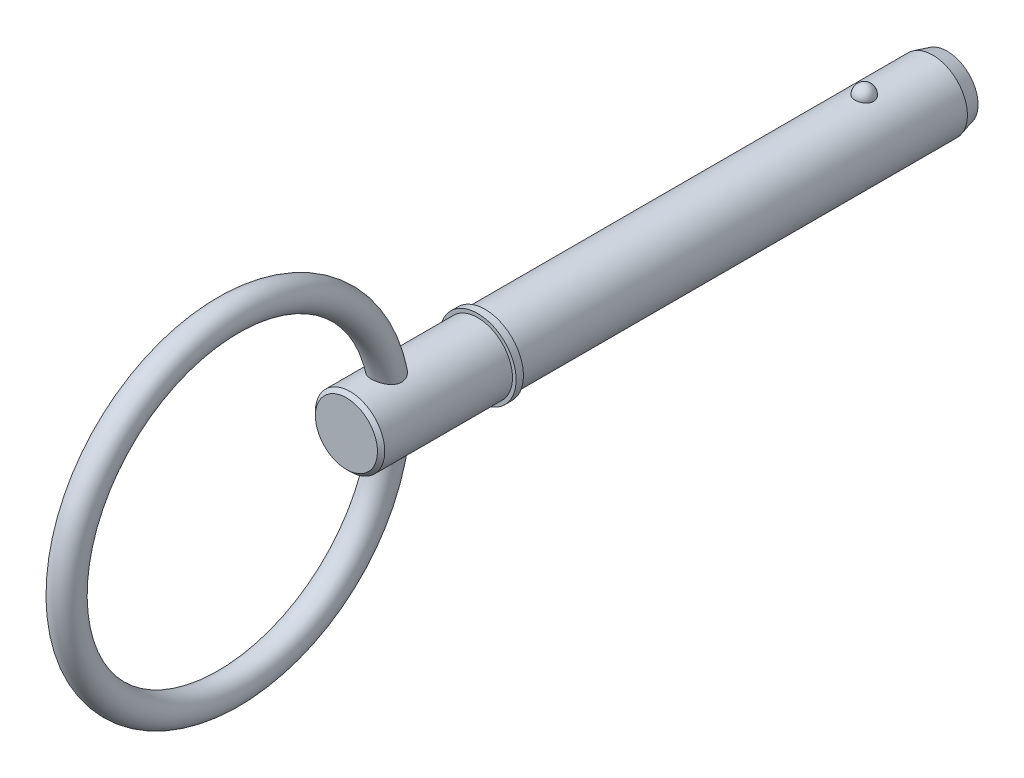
SolidWorks part; units mm, degrees
ref_plane "Front Plane" through (0, 0, 0) normal (0, 0, 1) x (1, 0, 0)
ref_plane "Top Plane" through (0, 0, 0) normal (0, 1, 0) x (1, 0, 0)
ref_plane "Right Plane" through (0, 0, 0) normal (1, 0, 0) x (0, 0, -1)
sketch "Sketch2" plane through (0, 0, 0) normal (0, 0, 1) x (1, 0, 0)
  circle A0 centre (0, 0) radius 4.765
  point P3 (0, 4.765)
  dimension "D1" = 9.53
extrude "Boss-Extrude1" add sketch "Sketch2" along normal blind 50.8
sketch "Sketch3" plane through (0, 0, 0) normal (0, 0, -1) x (-1, 0, 0)
  circle A0 centre (0, 0) radius 4.765
  dimension "D1" = 9.53
extrude "Boss-Extrude2" add sketch "Sketch3" along normal blind 12.7
chamfer "Chamfer1" distance 2 angle 15 1 edges at (-4.765, 0, -12.7)
sketch "Sketch18" plane through (0, 0, 0) normal (1, 0, 0) x (0, 0, -1)
  line L0 (10.7, 4.765) -> (-50.8, 4.765) construction
  line L1 (1.29, 6.055) -> (1.29, 3.475)
  line L2 (-50.8, -4.765) -> (10.7, -4.765) construction
  arc A0 (1.29, 6.055) -> (1.29, 3.475) centre (1.29, 4.765) ccw
  point P4 (0, 4.765)
  dimension "D1" = 10.82
revolve "Revolve1" add sketch "Sketch18" angle 360 about L1
sketch "Sketch19" plane through (0, 0, 0) normal (1, 0, 0) x (0, 0, -1)
  line L0 (-33.7288, 0) -> (-46.4542, 0) construction
sketch "Sketch20" plane through (0, 0, 0) normal (1, 0, 0) x (0, 0, -1)
  line L0 (-50.8, 0) -> (-50.8, 5.265)
  line L1 (-50.8, 4.765) -> (-50.8, -4.765) construction
  line L2 (-50.8, 5.265) -> (-51.8, 5.265)
  line L3 (-51.8, 5.265) -> (-51.8, 0)
  line L4 (-33.7288, 0) -> (-46.4542, 0) construction
  line L5 (-51.8, 0) -> (-50.8, 0)
  dimension "D1" = 5.265
  dimension "D2" = 1
revolve "Revolve2" add sketch "Sketch20" angle 360 about L0
sketch "Sketch21" plane through (0, 0, 50.8) normal (0, 0, -1) x (-1, 0, 0)
  circle A0 centre (0, 0) radius 4.765
  dimension "D1" = 9.53
extrude "Boss-Extrude3" add sketch "Sketch21" against normal blind 19.05
chamfer "Chamfer2" distance 0.5 angle 45 1 edges at (-4.765, 0, 69.85)
sketch "Sketch23" plane through (0, 0, 0) normal (1, 0, 0) x (0, 0, -1)
  line L0 (-69.85, 4.265) -> (-69.85, -4.265) construction
  circle A0 centre (-86.075, 0) radius 22.225
  point P2 (-63.85, 0)
  dimension "D1" = 44.45
  dimension "D2" = 6
sketch "Sketch24" plane through (0, 0, 0) normal (0, 1, 0) x (1, 0, 0)
  circle A0 centre (0, -63.85) radius 2
  dimension "D1" = 4
sweep "Sweep1" add profiles "Sketch24" path "Sketch23"
